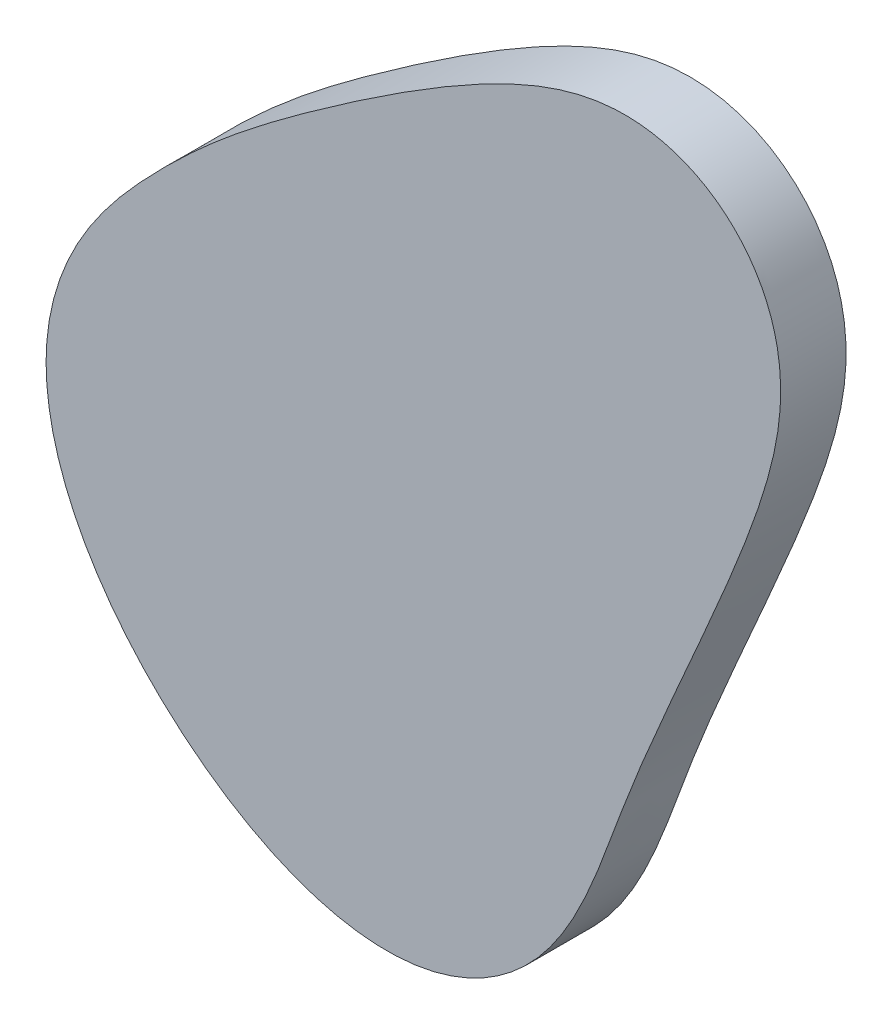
SolidWorks part; units mm, degrees
ref_plane "Front Plane" through (0, 0, 0) normal (0, 0, 1) x (1, 0, 0)
ref_plane "Top Plane" through (0, 0, 0) normal (0, 1, 0) x (1, 0, 0)
ref_plane "Right Plane" through (0, 0, 0) normal (1, 0, 0) x (0, 0, -1)
sketch "Sketch1" plane through (0, 0, 0) normal (0, 0, 1) x (1, 0, 0)
  point P0 (-50, 100)
  point P1 (-5, 138)
  point P2 (69, 177)
  point P3 (30, 50)
  point P5 (0, 0)
  point P6 (-70, 65)
  dimension "D1" = 20
  dimension "D2" = 65
  dimension "D3" = 70
  dimension "D4" = 139
  dimension "D5" = 100
  dimension "D6" = 50
  dimension "D7" = 65
  dimension "D8" = 100
  dimension "D9" = 177
  dimension "D10" = 138
sketch "Sketch2" plane through (0, 0, 0) normal (0, 0, 1) x (1, 0, 0)
  point P1 (39.3405, 46.4285)
  dimension "D1" = 10
extrude "Extrude-Thin1" add sketch "Sketch2" along normal mid plane 20 thin
sketch "Sketch3" plane through (0, 0, 10) normal (0, 0, 1) x (1, 0, 0)
  point P0 (39.3405, 46.4285)
extrude "Extrude1" add sketch "Sketch3" against normal up to surface (20 mm away)
